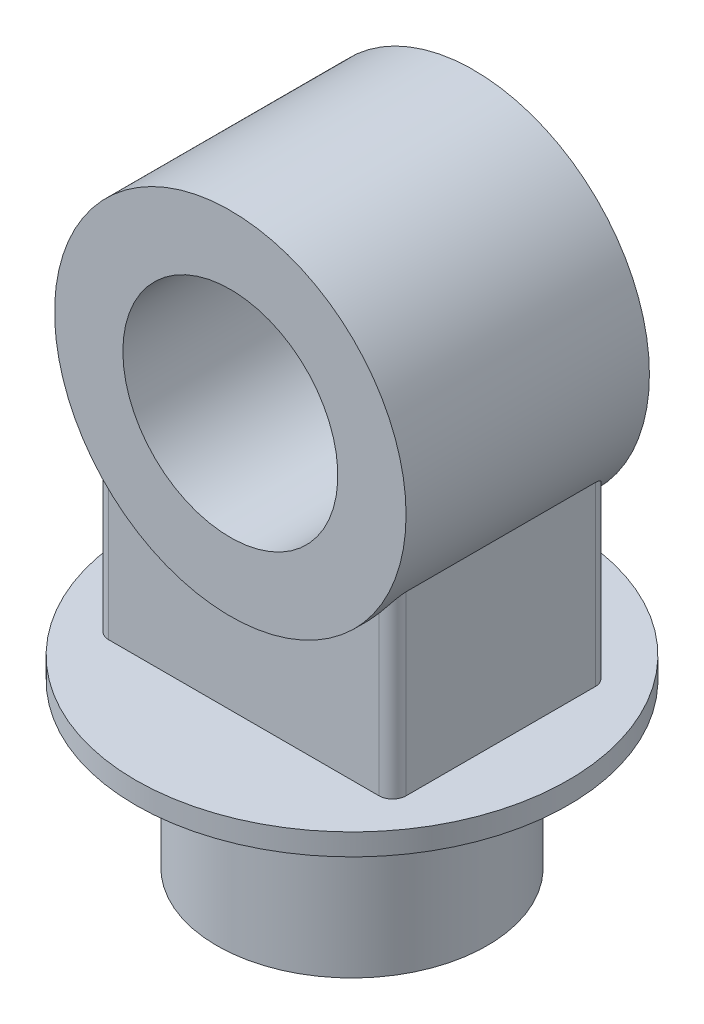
SolidWorks part; units mm, degrees
ref_plane "Front Plane" through (0, 0, 0) normal (0, 0, 1) x (1, 0, 0)
ref_plane "Top Plane" through (0, 0, 0) normal (0, 1, 0) x (1, 0, 0)
ref_plane "Right Plane" through (0, 0, 0) normal (1, 0, 0) x (0, 0, -1)
sketch "Sketch1" plane through (0, 0, 0) normal (0, 1, 0) x (1, 0, 0)
  circle A0 centre (0, 0) radius 100
  dimension "D1" = 200
extrude "Boss-Extrude1" add sketch "Sketch1" along normal blind 120
sketch "Sketch2" plane through (0, 120, 0) normal (0, 1, 0) x (1, 0, 0)
  circle A0 centre (0, 0) radius 160
  dimension "D1" = 320
extrude "Boss-Extrude2" add sketch "Sketch2" along normal blind 16
sketch "Sketch3" plane through (0, 0, 0) normal (0, 0, 1) x (1, 0, 0)
  line L0 (160, 136) -> (-160, 136) construction
  circle A0 centre (0, 336) radius 79.5
  circle A1 centre (0, 336) radius 130
  dimension "D1" = 159
  dimension "D2" = 260
  dimension "D3" = 200
extrude "Boss-Extrude3" add sketch "Sketch3" along normal mid plane 180 separate body
sketch "Sketch4" plane through (0, 136, 0) normal (0, 1, 0) x (1, 0, 0)
  line L1 (-110, -80) -> (110, -80)
  line L2 (-110, -80) -> (-110, 80)
  line L3 (-110, 80) -> (110, 80)
  line L4 (110, -80) -> (110, 80)
  line L5 (-110, -80) -> (110, 80) construction
  line L6 (-110, 80) -> (110, -80) construction
  point P0 (0, 0)
  dimension "D1" = 160
  dimension "D2" = 220
extrude "Boss-Extrude4" add sketch "Sketch4" along normal up to next
fillet "Fillet1" radius 10 4 edges at (-110, 201.359, 80) (-110, 201.359, -80) (110, 201.359, -80) (110, 201.359, 80)
